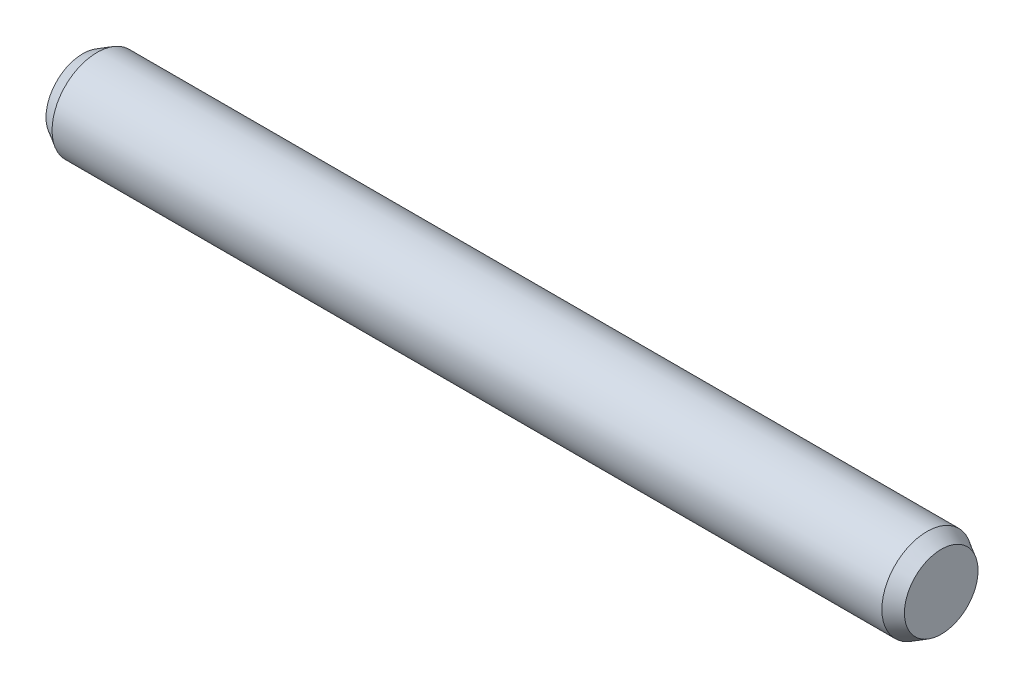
SolidWorks part; units mm, degrees
ref_plane "Front Plane" through (0, 0, 0) normal (0, 0, 1) x (1, 0, 0)
ref_plane "Top Plane" through (0, 0, 0) normal (0, 1, 0) x (1, 0, 0)
ref_plane "Right Plane" through (0, 0, 0) normal (1, 0, 0) x (0, 0, -1)
sketch "Sketch2" plane through (0, 0, 0) normal (0, 0, 1) x (1, 0, 0)
  line L0 (0, 0) -> (50000, 0) construction
  line L1 (0, 0) -> (0, 0.6535)
  line L2 (14.986, 0.8001) -> (0.254, 0.8001)
  line L3 (15.24, 0.6535) -> (15.24, 0)
  line L4 (15.24, 0) -> (0, 0)
  line L5 (15.24, 0.6535) -> (14.986, 0.8001)
  line L6 (0.254, 0.8001) -> (0, 0.6535)
  point P4 (0, 0.8001)
  point P6 (15.24, 0.8001)
  dimension "D1" = 15.24
  dimension "D2" = 1.6002
  dimension "D3" = 0.254
  dimension "D4" = 30
  dimension "D5" = 0.254
  dimension "D6" = 30
revolve "Revolve1" add sketch "Sketch2" angle 360 about L0
